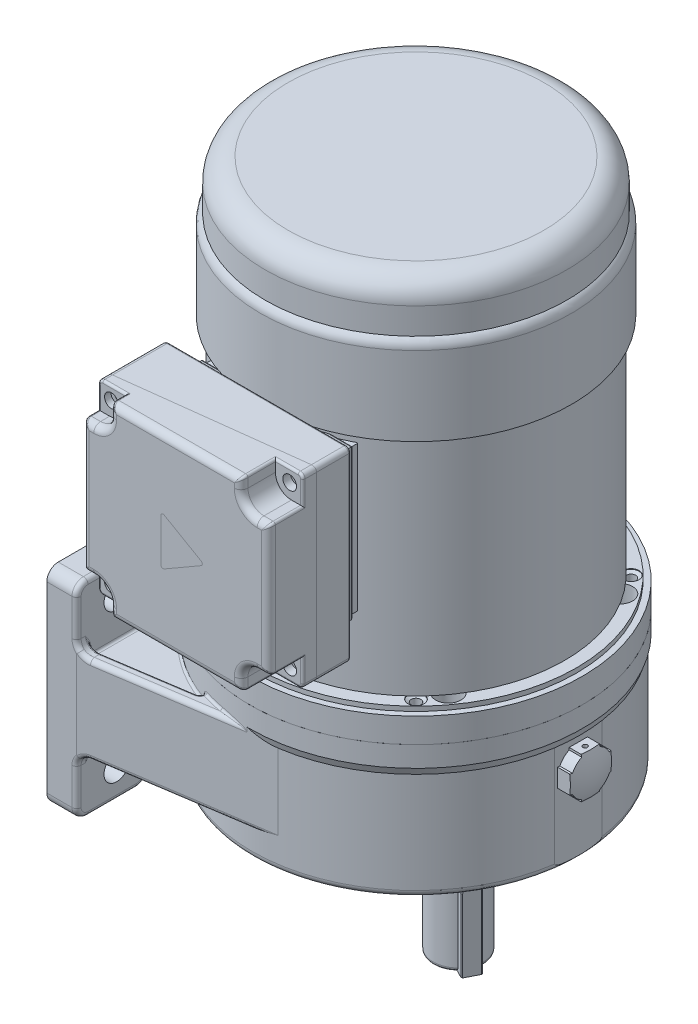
SolidWorks part; units mm, degrees
ref_plane "前视基准面" through (0, 0, 0) normal (0, 0, 1) x (1, 0, 0)
ref_plane "上视基准面" through (0, 0, 0) normal (0, 1, 0) x (1, 0, 0)
ref_plane "右视基准面" through (0, 0, 0) normal (1, 0, 0) x (0, 0, -1)
imported_body "接线盒座-1-surface1"
imported_body "接线盒座-1-surface2"
imported_body "接线盒座-1-surface3"
imported_body "接线盒座-1-surface4"
imported_body "接线盒座-1-surface5"
imported_body "接线盒座-1-surface6"
imported_body "接线盒盖-1-surface1"
imported_body "接线盒盖-1-surface2"
imported_body "接线盒盖-1-surface3"
imported_body "接线盒盖-1-surface4"
imported_body "卧式箱体装配.SLDPRT-1/15.11.08 22箱盖B-1-surface1"
imported_body "卧式箱体装配.SLDPRT-1/3轴22-1-surface1"
imported_body "卧式箱体装配.SLDPRT-1/3轴22-1-surface2"
imported_body "卧式箱体装配.SLDPRT-1/15.05.20 22卧式箱体B-2-surface1"
imported_body "卧式箱体装配.SLDPRT-1/透气塞-1-surface1"
imported_body "卧式箱体装配.SLDPRT-1/7X32-1-surface1"
imported_body "卧式箱体装配.SLDPRT-1/GB／T13871．1-2007唇形密封圈B型B1525X40X7-1-surface1"
sketch "草图1" plane through (0, -115.1427, 0) normal (0, 1, 0) x (1, 0, 0)
  circle A2 centre (335.3803, 88.2627) radius 65
extrude "凸台-拉伸1" add sketch "草图1" along normal blind 98.5
sketch "草图2" plane through (0, -16.6427, 0) normal (0, 1, 0) x (1, 0, 0)
  circle A0 centre (335.3803, 88.2627) radius 68
extrude "凸台-拉伸2" add sketch "草图2" along normal blind 33.5
sketch "草图3" plane through (0, 16.8573, 0) normal (0, 1, 0) x (1, 0, 0)
  circle A0 centre (335.3803, 88.2627) radius 68
extrude "凸台-拉伸3" add sketch "草图3" along normal blind 5
sketch "草图4" plane through (0, 21.8573, 0) normal (0, 1, 0) x (1, 0, 0)
  circle A0 centre (335.3803, 88.2627) radius 66
extrude "凸台-拉伸4" add sketch "草图4" along normal blind 21.5
fillet "圆角2" radius 5 1 edges at (335.3803, 21.8573, -20.2627)
fillet "圆角3" radius 10 1 edges at (335.3803, 43.3573, -22.2627)
